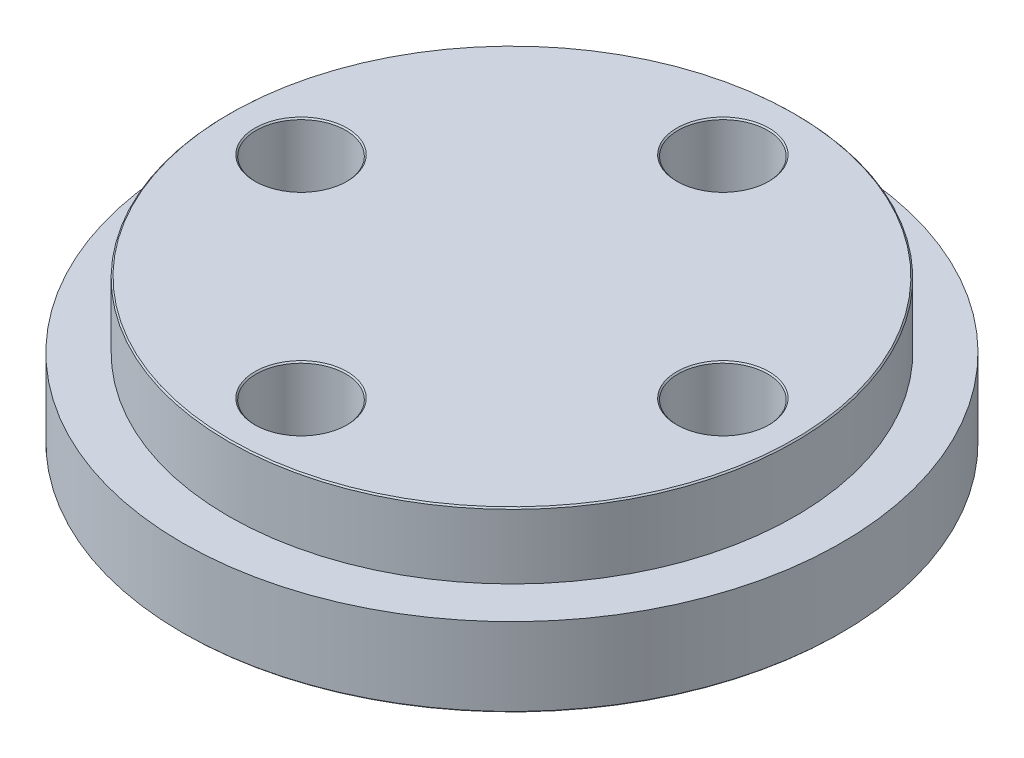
SolidWorks part; units mm, degrees
ref_plane "Спереди" through (0, 0, 0) normal (0, 0, 1) x (1, 0, 0)
ref_plane "Сверху" through (0, 0, 0) normal (0, 1, 0) x (1, 0, 0)
ref_plane "Справа" through (0, 0, 0) normal (1, 0, 0) x (0, 0, -1)
sketch "Эскиз1" plane through (0, 0, 0) normal (0, 1, 0) x (1, 0, 0)
  circle A0 centre (0, 0) radius 25
  dimension "D1" = 50
extrude "Бобышка-Вытянуть1" add sketch "Эскиз1" along normal blind 6
sketch "Эскиз2" plane through (0, 6, 0) normal (0, 1, 0) x (1, 0, 0)
  circle A0 centre (0, 0) radius 21.5
  dimension "D1" = 43
extrude "Бобышка-Вытянуть2" add sketch "Эскиз2" along normal blind 5
sketch "Эскиз3" plane through (0, 0, 0) normal (0, -1, 0) x (1, 0, 0)
  circle A0 centre (0, 16) radius 3.4
  circle A1 centre (0, 0) radius 25 construction
  dimension "D1" = 6.8
  dimension "D2" = 16
extrude "Вырез-Вытянуть1" cut sketch "Эскиз3" against normal through all
pattern_circular "Круговой массив1" count 4 over 360 about axis through (0, 0, 0) along (0, 1, 0) of "Вырез-Вытянуть1"
chamfer "Фаска1" distance 0.1 angle 45 10 edges at (0, 11, 21.5) (0, 11, 12.6) (-12.6, 11, 0) (0, 11, -12.6) (12.6, 11, 0) (0, 0, 25) (0, 0, 12.6) (-12.6, 0, 0) (0, 0, -12.6) (12.6, 0, 0)
